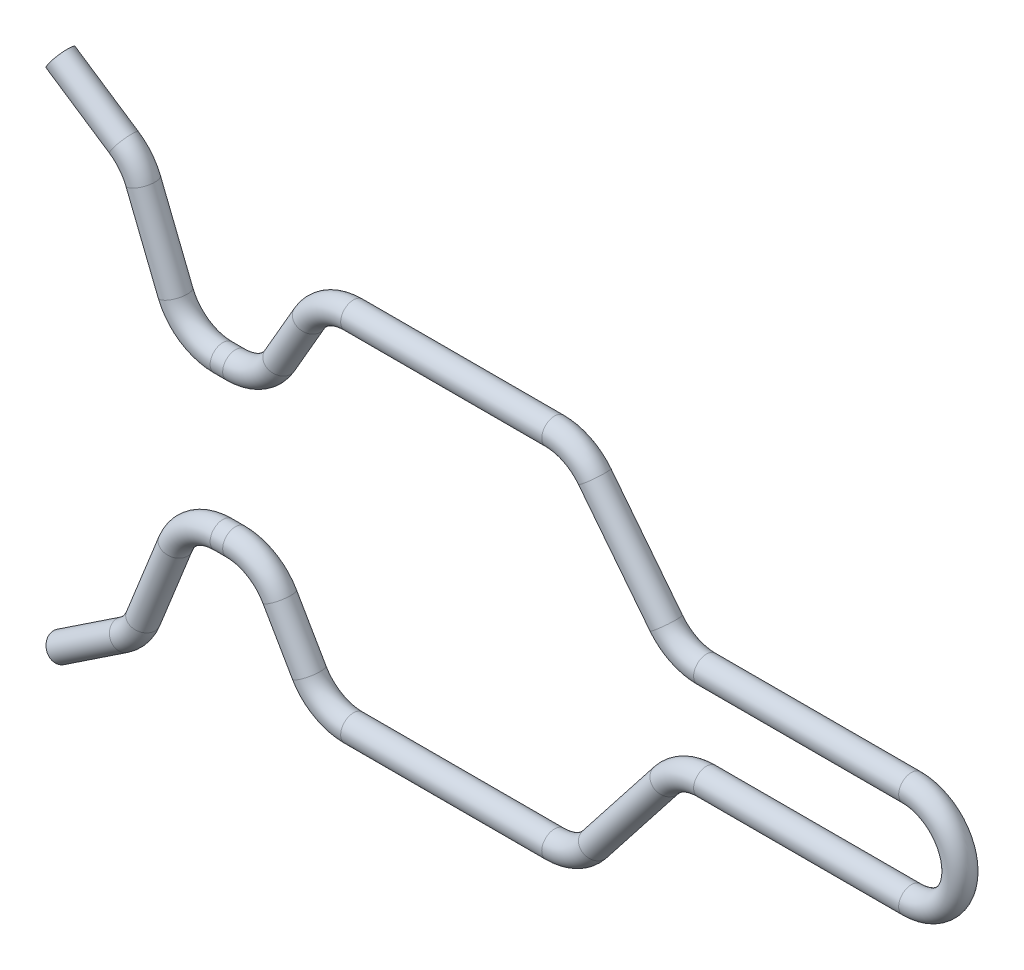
SolidWorks part; units mm, degrees
ref_plane "Plan de face" through (0, 0, 0) normal (0, 0, 1) x (1, 0, 0)
ref_plane "Plan de dessus" through (0, 0, 0) normal (0, 1, 0) x (1, 0, 0)
ref_plane "Plan de droite" through (0, 0, 0) normal (1, 0, 0) x (0, 0, -1)
sketch "Esquisse1" plane through (0, 0, 0) normal (0, 0, 1) x (1, 0, 0)
  line L0 (0, 1.9) -> (-8.0269, 1.9)
  line L1 (-9.6006, 2.6657) -> (-12.3994, 6.2343)
  line L2 (-13.9731, 7) -> (-21.8453, 7)
  line L3 (-23.5774, 6) -> (-24.7321, 4)
  line L4 (-26.4641, 3) -> (-26.9553, 3)
  line L5 (-28.8123, 4.2572) -> (-30.0787, 7.4232)
  line L6 (-30.8263, 8.3446) -> (-33.3094, 10)
  line L7 (0, 0) -> (2.9878, 0) construction
  arc A0 (1.9, 0) -> (0, 1.9) centre (0, 0) ccw
  arc A1 (-8.0269, 1.9) -> (-9.6006, 2.6657) centre (-8.0269, 3.9) cw
  arc A2 (-12.3994, 6.2343) -> (-13.9731, 7) centre (-13.9731, 5) ccw
  arc A3 (-21.8453, 7) -> (-23.5774, 6) centre (-21.8453, 5) ccw
  arc A4 (-24.7321, 4) -> (-26.4641, 3) centre (-26.4641, 5) cw
  arc A5 (-26.9553, 3) -> (-28.8123, 4.2572) centre (-26.9553, 5) cw
  arc A6 (-30.0787, 7.4232) -> (-30.8263, 8.3446) centre (-31.9357, 6.6805) ccw
  point P14 (-9, 1.9)
  point P17 (-13, 7)
  point P20 (-23, 7)
  point P23 (-25.3094, 3)
  point P26 (-28.3094, 3)
  point P29 (-30.3094, 8)
  dimension "D1" = 3.8
  dimension "D13" = 2
  dimension "D2" = 9
  dimension "D3" = 4
  dimension "D4" = 7
  dimension "D5" = 10
  dimension "D6" = 120
  dimension "D7" = 3
  dimension "D8" = 3
  dimension "D9" = 2
  dimension "D10" = 5
  dimension "D11" = 3
  dimension "D12" = 2
sketch "Esquisse2" plane through (0, 0, 0) normal (0, 1, 0) x (1, 0, 0)
  line L0 (0, 0) -> (1.9, 0) construction
  line L1 (0, 0) -> (2.9878, 0) construction
  circle A0 centre (1.9, 0) radius 0.5
  dimension "D1" = 1
  dimension "D2" = 1.9
sweep "Balayage1" add profiles "Esquisse2" path "Esquisse1"
mirror "Symétrie1" about plane through (1.9, 0, 0) normal (0, 1, 0) of "Balayage1"
